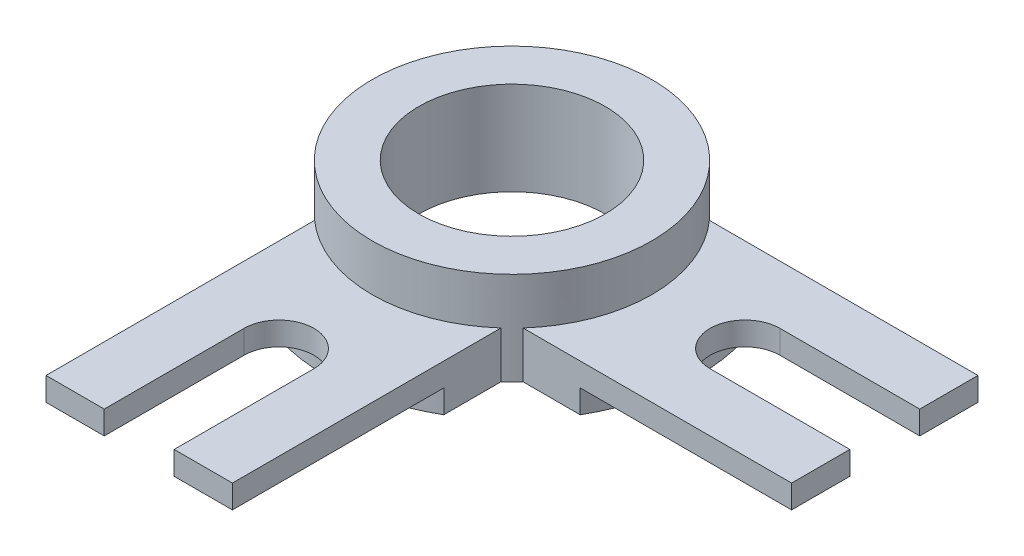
SolidWorks part; units mm, degrees
ref_plane "正面" through (0, 0, 0) normal (0, 0, 1) x (1, 0, 0)
ref_plane "平面" through (0, 0, 0) normal (0, 1, 0) x (1, 0, 0)
ref_plane "右側面" through (0, 0, 0) normal (1, 0, 0) x (0, 0, -1)
sketch "ｽｹｯﾁ1" plane through (0, 0, 0) normal (0, 1, 0) x (1, 0, 0)
  circle A0 centre (0, 0) radius 30
  dimension "D1" = 60
extrude "押し出し1" add sketch "ｽｹｯﾁ1" along normal blind 20
sketch "ｽｹｯﾁ2" plane through (0, 0, 0) normal (0, -1, 0) x (1, 0, 0)
  line L0 (0, 0) -> (80, 0) construction
  line L1 (0, 20) -> (80, 20)
  line L2 (0, 20) -> (0, -20)
  line L3 (0, -20) -> (80, -20)
  line L4 (80, 20) -> (80, -20)
  dimension "D1" = 40
  dimension "D2" = 80
extrude "押し出し2" add sketch "ｽｹｯﾁ2" against normal blind 10
sketch "ｽｹｯﾁ3" plane through (0, 10, 0) normal (0, 1, 0) x (1, 0, 0)
  line L0 (80, 0) -> (50, 0) construction
  line L1 (80, 20) -> (80, -20) construction
  line L2 (50, 7.5) -> (80, 7.5)
  line L3 (80, 7.5) -> (80, -7.5)
  line L4 (80, -7.5) -> (50, -7.5)
  arc A0 (50, 7.5) -> (50, -7.5) centre (50, 0) ccw
  dimension "D1" = 50
  dimension "D2" = 15
extrude "ｶｯﾄ - 押し出し1" cut sketch "ｽｹｯﾁ3" against normal through all
sketch "ｽｹｯﾁ4" plane through (0, 0, 0) normal (0, -1, 0) x (1, 0, 0)
  circle A0 centre (0, 0) radius 40
  dimension "D1" = 80
extrude "ｶｯﾄ - 押し出し2" cut sketch "ｽｹｯﾁ4" against normal blind 5 flip side to cut
pattern_circular "円形ﾊﾟﾀｰﾝ1" count 2 every 90 about axis through (0, 0, 0) along (0, 1, 0) of "押し出し2", "ｶｯﾄ - 押し出し1", "ｶｯﾄ - 押し出し2"
sketch "ｽｹｯﾁ5" plane through (0, 20, 0) normal (0, 1, 0) x (1, 0, 0)
  circle A0 centre (0, 0) radius 20
  dimension "D1" = 40
extrude "ｶｯﾄ - 押し出し3" cut sketch "ｽｹｯﾁ5" against normal through all
